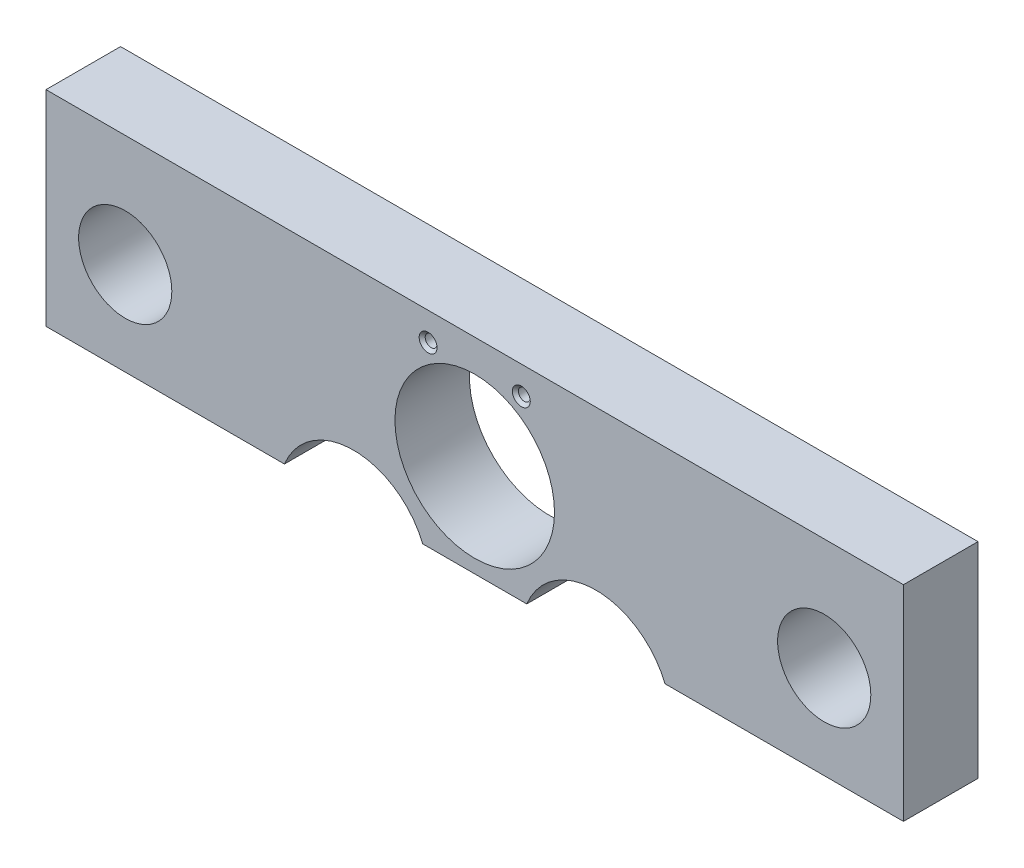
SolidWorks part; units mm, degrees
ref_plane "Front" through (0, 0, 0) normal (0, 0, 1) x (1, 0, 0)
ref_plane "Top" through (0, 0, 0) normal (0, 1, 0) x (1, 0, 0)
ref_plane "Right" through (0, 0, 0) normal (1, 0, 0) x (0, 0, -1)
sketch "Sketch1" plane through (0, 0, 0) normal (0, 0, 1) x (1, 0, 0)
  line L1 (0, 0) -> (292.1, 0)
  line L2 (0, 0) -> (0, 76.2)
  line L3 (0, 76.2) -> (292.1, 76.2)
  line L4 (292.1, 0) -> (292.1, 76.2)
  dimension "D1" = 76.2
  dimension "D2" = 292.1
extrude "Boss-Extrude1" add sketch "Sketch1" along normal blind 25.4
sketch "Sketch2" plane through (0, 0, 25.4) normal (0, 0, 1) x (1, 0, 0)
  line L0 (0, 0) -> (292.1, 0) construction
  line L1 (0, 76.2) -> (0, 0) construction
  circle A0 centre (146.05, 38.1) radius 27.178
  dimension "D3" = 54.356
  dimension "D1" = 38.1
  dimension "D2" = 146.05
extrude "Cut-Extrude1" cut sketch "Sketch2" against normal through all both and the other way through all
sketch "Sketch3" plane through (0, 0, 25.4) normal (0, 0, 1) x (1, 0, 0)
  line L0 (53.975, 0) -> (53.975, 76.2) construction
  line L1 (0, 0) -> (292.1, 0) construction
  line L2 (292.1, 76.2) -> (0, 76.2) construction
  line L3 (238.125, 76.2) -> (238.125, 0) construction
  line L4 (0, 76.2) -> (0, 0) construction
  dimension "D1" = 184.15
  dimension "D2" = 53.975
hole_wizard "1/2 (1.25) Diameter Hole1" positions "Sketch4" profile "Sketch5" hole size "1/2" standard "ANSI Inch"
sketch "Sketch4" plane through (0, 0, 25.4) normal (0, 0, 1) x (1, 0, 0)
  line L0 (0, 0) -> (292.1, 0) construction
  line L1 (0, 76.2) -> (0, 0) construction
  line L2 (292.1, 0) -> (292.1, 76.2) construction
  point P0 (26.9875, 38.1)
  point P2 (265.1125, 38.1)
  dimension "D1" = 38.1
  dimension "D2" = 26.9875
  dimension "D3" = 26.9875
sketch "Sketch5" plane through (26.9875, 38.1, 25.4) normal (1, 0, 0) x (0, -1, 0)
  line L0 (0, 0) -> (0, 25.4)
  line L1 (0, 25.4) -> (15.875, 25.4)
  line L2 (15.875, 25.4) -> (15.875, 0)
  line L5 (15.875, 0) -> (0, 0)
  line L11 (0, -6.35) -> (0, 107.95) construction
  dimension "Thru Hole Dia." = 31.75
  dimension "Thru Hole Depth" = 25.4
sketch "Sketch6" plane through (0, 0, 25.4) normal (0, 0, 1) x (1, 0, 0)
  circle A0 centre (104.775, -3.175) radius 25.4
  circle A1 centre (187.325, -3.175) radius 25.4
  circle A2 centre (146.05, 38.1) radius 27.178 construction
  dimension "D1" = 50.8
  dimension "D2" = 82.55
  dimension "D3" = 41.275
  dimension "D4" = 41.275
extrude "Cut-Extrude2" cut sketch "Sketch6" against normal through all
sketch "Sketch7" plane through (0, 0, 25.4) normal (0, 0, 1) x (1, 0, 0)
  line L0 (292.1, 0) -> (292.1, 76.2) construction
  line L1 (0, 0) -> (292.1, 0)
  line L2 (0, 0) -> (0, 6.35)
  line L3 (0, 6.35) -> (292.1, 6.35)
  line L4 (292.1, 0) -> (292.1, 6.35)
  dimension "D1" = 6.35
extrude "Cut-Extrude3" cut sketch "Sketch7" against normal through all both and the other way through all
sketch "Sketch8" plane through (0, 0, 25.4) normal (0, 0, 1) x (1, 0, 0)
  circle A0 centre (26.9875, 38.1) radius 23.4685
  circle A1 centre (265.1125, 38.1) radius 21.5029
sketch "Sketch9" [suppressed] plane through (0, 0, 0) normal (0, 0, -1) x (-1, 0, 0)
  line L0 (-238.125, 76.2) -> (-238.125, 0) construction
  line L1 (-292.1, 76.2) -> (-238.125, 76.2)
  line L2 (-292.1, 76.2) -> (-292.1, 6.2493)
  line L3 (-292.1, 6.2493) -> (-238.125, 6.2493)
  line L4 (-238.125, 76.2) -> (-238.125, 6.2493)
  line L5 (-53.975, 0) -> (-53.975, 76.2) construction
  line L6 (0, 76.2) -> (-53.975, 76.2)
  line L7 (0, 76.2) -> (0, 6.35)
  line L8 (0, 6.35) -> (-53.975, 6.35)
  line L9 (-53.975, 76.2) -> (-53.975, 6.35)
  line L10 (-81.2286, 6.35) -> (0, 6.35) construction
sketch "Sketch10" plane through (0, 0, 25.4) normal (0, 0, 1) x (1, 0, 0)
  circle A0 centre (146.05, 38.1) radius 38.1
hole_wizard "Single #10-32 Tapped Hole1" positions "Sketch11" profile "Sketch12" tap size "#10-32" standard "ANSI Inch"
sketch "Sketch11" plane through (0, 0, 25.4) normal (0, 0, 1) x (1, 0, 0)
  line L0 (147.0923, 39.0651) -> (26.9875, 38.1) construction
  line L1 (147.0923, 39.0651) -> (123.9845, 61.8045) construction
  circle A0 centre (146.05, 38.1) radius 27.051 construction
  point P0 (123.9845, 61.8045)
  dimension "D1" = 32.385
  dimension "D2" = 45
sketch "Sketch12" plane through (123.9845, 61.8045, 25.4) normal (1, 0, 0) x (0, -1, 0)
  line L0 (0, 0) -> (0, 25.4)
  line L1 (0, 25.4) -> (3.048, 25.4)
  line L2 (2.0193, 24.3713) -> (2.0193, 1.0287)
  line L3 (2.0193, 1.0287) -> (3.048, 0)
  line L5 (3.048, 0) -> (0, 0)
  line L6 (-2.0193, 1.0287) -> (-3.048, 0) construction
  line L7 (3.048, 25.4) -> (2.0193, 24.3713)
  line L8 (-3.048, 25.4) -> (-2.0193, 24.3713) construction
  line L11 (0, -6.35) -> (0, 107.95) construction
  dimension "Thru Tap Drill Dia." = 4.0386
  dimension "Thru Tap Drill Depth" = 25.4
  dimension "Near C'Sink Dia." = 6.096
  dimension "Near C'Sink Angle" = 90
  dimension "Far C'Sink Dia." = 6.096
  dimension "Far C'Sink Angle" = 90
hole_wizard "Double #10-32 Tapped Hole2" positions "Sketch13" profile "Sketch14" tap size "#10-32" standard "ANSI Inch"
sketch "Sketch13" plane through (0, 0, 25.4) normal (0, 0, 1) x (1, 0, 0)
  line L0 (146.05, 38.1) -> (146.05, 84.8247) construction
  point P0 (130.175, 66.675)
  point P2 (161.925, 66.675)
  dimension "D1" = 31.75
  dimension "D2" = 15.875
  dimension "D3" = 28.575
sketch "Sketch14" plane through (130.175, 66.675, 25.4) normal (1, 0, 0) x (0, -1, 0)
  line L0 (0, 0) -> (0, 25.4)
  line L1 (0, 25.4) -> (3.048, 25.4)
  line L2 (2.0193, 24.3713) -> (2.0193, 1.0287)
  line L3 (2.0193, 1.0287) -> (3.048, 0)
  line L5 (3.048, 0) -> (0, 0)
  line L6 (-2.0193, 1.0287) -> (-3.048, 0) construction
  line L7 (3.048, 25.4) -> (2.0193, 24.3713)
  line L8 (-3.048, 25.4) -> (-2.0193, 24.3713) construction
  line L11 (0, -6.35) -> (0, 107.95) construction
  dimension "Thru Tap Drill Dia." = 4.0386
  dimension "Thru Tap Drill Depth" = 25.4
  dimension "Near C'Sink Dia." = 6.096
  dimension "Near C'Sink Angle" = 90
  dimension "Far C'Sink Dia." = 6.096
  dimension "Far C'Sink Angle" = 90
